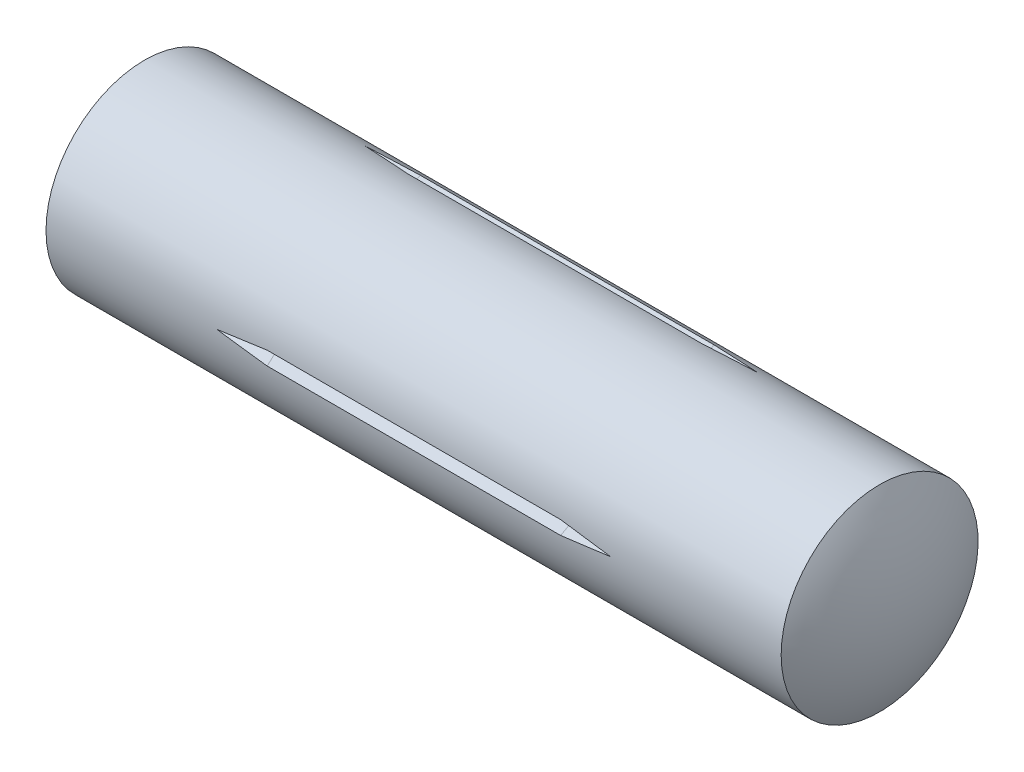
SolidWorks part; units mm, degrees
ref_plane "Plane1" through (0, 0, 0) normal (0, 0, 1) x (1, 0, 0)
ref_plane "Plane2" through (0, 0, 0) normal (0, 1, 0) x (1, 0, 0)
ref_plane "Plane3" through (0, 0, 0) normal (1, 0, 0) x (0, 0, -1)
sketch "Sketch1" plane through (0, 0, 0) normal (0, 0, 1) x (1, 0, 0)
  line L0 (-57, 0) -> (60, 0) construction
  line L1 (-50, 0) -> (-50, 1.25)
  line L2 (-46.6819, 12.5) -> (46.6506, 12.5)
  line L3 (-50, 0) -> (50, 0)
  arc A0 (-46.6819, 12.5) -> (-50, 1.25) centre (-25.0313, 0) ccw
  arc A1 (50, 0) -> (46.6506, 12.5) centre (25, 0) ccw
  dimension "D1" = 25
  dimension "D2" = 25
  dimension "Diameter" = 25
  dimension "D3" = 2.5
  dimension "Length" = 100
revolve "Base-Revolve" add sketch "Sketch1" angle 360 about L0
sketch "Sketch3" plane through (0, 0, 0) normal (0, 1, 0) x (1, 0, 0)
  line L0 (0, 0) -> (60, 0) construction
  line L1 (-57, 0) -> (60, 0) construction
  line L2 (-25, -12.5) -> (-18.75, -11.25)
  line L3 (-18.75, -11.25) -> (18.75, -11.25)
  line L4 (18.75, -11.25) -> (25, -12.5)
  dimension "D1" = 25
  dimension "D2" = 50
  dimension "D3" = 25
  dimension "D4" = 22.5
  dimension "D5" = 6.25
  dimension "D6" = 6.25
ref_plane "Plane4" through (-25, 0, 0) normal (1, 0, 0) x (0, 0, -1)
sketch "Sketch4" plane through (-25, 0, 0) normal (1, 0, 0) x (0, 0, -1)
  line L0 (0, 0) -> (-14, 0) construction
  line L1 (-12.5, 0) -> (-14.3784, 1.3152)
  line L2 (-12.5, 0) -> (-14.3784, -1.3152)
  line L3 (-14.3784, -1.3152) -> (-14.3784, 1.3152)
  circle A0 centre (0, 0) radius 12.5 construction
  dimension "D1" = 25
  dimension "D2" = 70
  dimension "D3" = 35
  dimension "D4" = 1.8784
sweep "Cut-Sweep3" cut profiles "Sketch4" path "Sketch3"
pattern_circular "CirPattern2" count 3 over 360 about axis through (0, 0, 0) along (1, 0, 0) of "Cut-Sweep3"
equation "\"D1@Sketch1\" = \"Diameter@Sketch1\""
equation "\"D2@Sketch1\" = \"Diameter@Sketch1\""
equation "\"D3@Sketch1\" = \"Diameter@Sketch1\" * .1"
equation "\"D1@Sketch3\" = \"Diameter@Sketch1\""
equation "\"D2@Sketch3\" = \"Length@Sketch1\" / 2"
equation "\"D3@Sketch3\" = \"D2@Sketch3\" / 2"
equation "\"D4@Sketch3\" = \"Diameter@Sketch1\" * .9"
equation "\"D5@Sketch3\" = \"D1@Sketch1\" / 4"
equation "\"D6@Sketch3\" = \"D5@Sketch3\""
equation "\"D1@Plane4\" = \"D3@Sketch3\""
equation "\"D1@Sketch4\" = \"Diameter@Sketch1\""
equation "\"D3@Sketch4\" = \"D2@Sketch4\" / 2"
